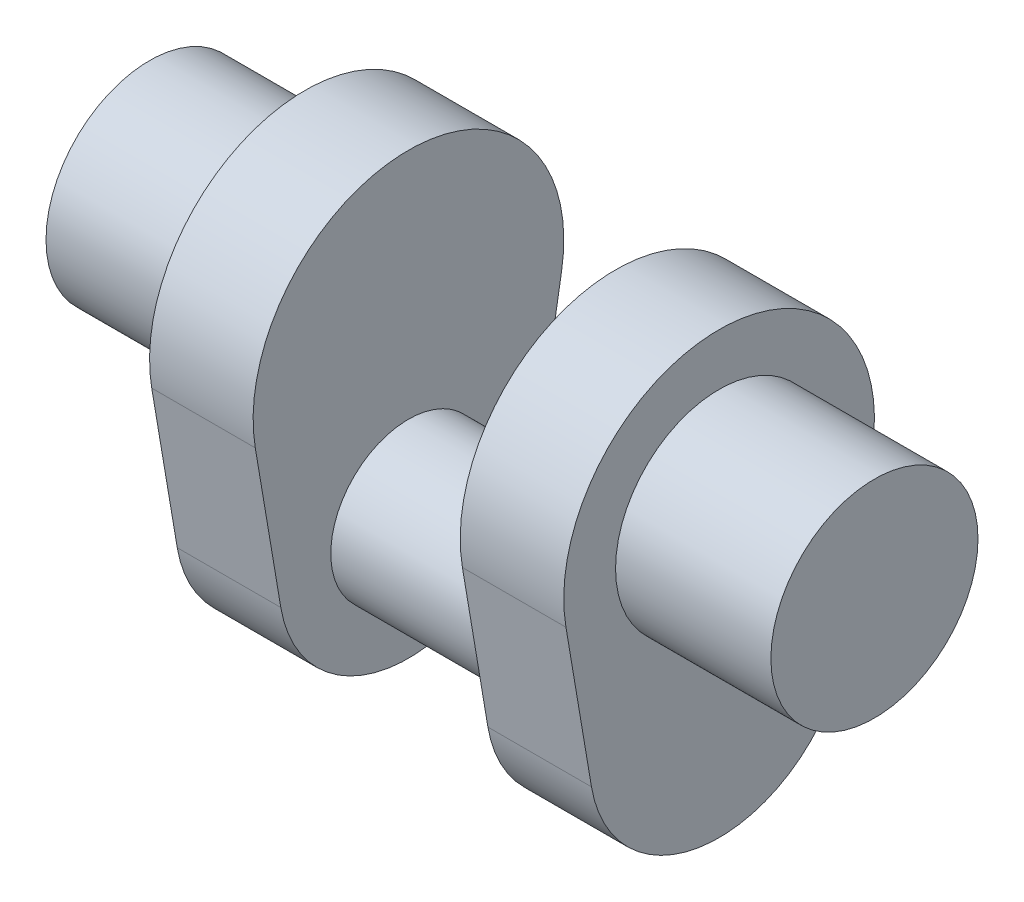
SolidWorks part; units mm, degrees
ref_plane "Front Plane" through (0, 0, 0) normal (0, 0, 1) x (1, 0, 0)
ref_plane "Top Plane" through (0, 0, 0) normal (0, 1, 0) x (1, 0, 0)
ref_plane "Right Plane" through (0, 0, 0) normal (1, 0, 0) x (0, 0, -1)
sketch "Sketch1" plane through (0, 0, 0) normal (1, 0, 0) x (0, 0, -1)
  circle A0 centre (0, 0) radius 15
  dimension "D1" = 30
extrude "Boss-Extrude1" add sketch "Sketch1" along normal mid plane 40
sketch "Sketch2" plane through (20, 0, 0) normal (1, 0, 0) x (0, 0, -1)
  line L0 (-29.5804, 25) -> (-24.6503, -4.1667)
  line L1 (29.5804, 25) -> (24.6503, -4.1667)
  arc A0 (-24.6503, -4.1667) -> (24.6503, -4.1667) centre (0, 0) ccw
  arc A1 (29.5804, 25) -> (-29.5804, 25) centre (0, 30) ccw
  dimension "D2" = 25
  dimension "D3" = 30
  dimension "D1" = 30
extrude "Boss-Extrude2" add sketch "Sketch2" along normal blind 20
mirror "Mirror1" about plane through (0, 0, 0) normal (1, 0, 0) of "Boss-Extrude2"
sketch "Sketch3" plane through (40, 0, 0) normal (1, 0, 0) x (0, 0, -1)
  circle A0 centre (0, 30) radius 20
  dimension "D1" = 40
extrude "Boss-Extrude3" add sketch "Sketch3" along normal blind 30
mirror "Mirror2" about plane through (0, 0, 0) normal (1, 0, 0) of "Boss-Extrude3"
